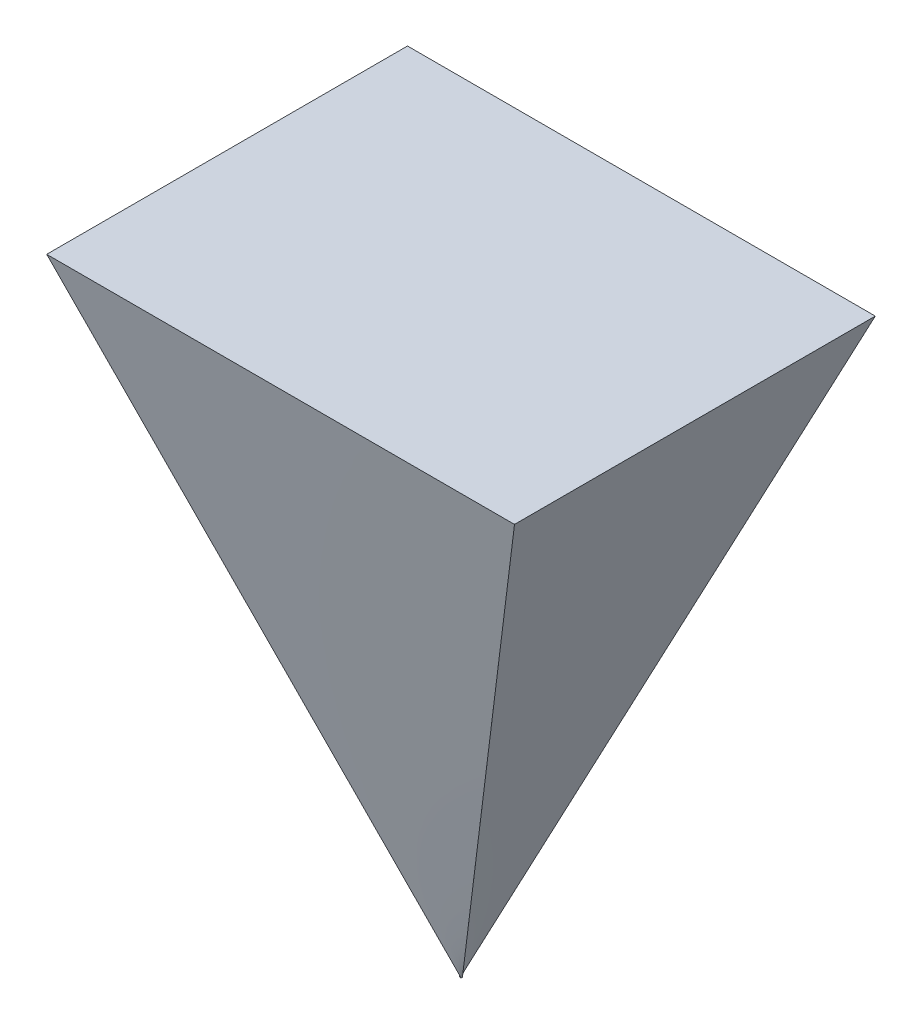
SolidWorks part; units mm, degrees
ref_plane "Front Plane" through (0, 0, 0) normal (0, 0, 1) x (1, 0, 0)
ref_plane "Top Plane" through (0, 0, 0) normal (0, 1, 0) x (1, 0, 0)
ref_plane "Right Plane" through (0, 0, 0) normal (1, 0, 0) x (0, 0, -1)
ref_plane "Plane1" through (0, 2489.2, 0) normal (0, 1, 0) x (-1, 0, 0)
ref_plane "Plane2" through (0, 4978.4, 0) normal (0, 1, 0) x (-1, 0, 0)
sketch "Sketch1" plane through (0, 0, 0) normal (0, 1, 0) x (1, 0, 0)
  line L1 (-6.477, 5.3086) -> (6.477, 5.3086)
  line L2 (-6.477, 5.3086) -> (-6.477, -5.334)
  line L3 (-6.477, -5.334) -> (6.477, -5.334)
  line L4 (6.477, 5.3086) -> (6.477, -5.334)
  dimension "D1" = 10.6426
  dimension "D2" = 12.954
  dimension "D3" = 5.334
  dimension "D4" = 6.477
sketch "Sketch2" plane through (0, 2489.2, 0) normal (0, 1, 0) x (-1, 0, 0)
  line L1 (-1468.12, 1181.1) -> (1452.88, 1181.1)
  line L2 (-1468.12, 1181.1) -> (-1468.12, -1168.4)
  line L3 (-1468.12, -1168.4) -> (1452.88, -1168.4)
  line L4 (1452.88, 1181.1) -> (1452.88, -1168.4)
  dimension "D1" = 2349.5
  dimension "D2" = 2921
  dimension "D3" = 1468.12
  dimension "D4" = 1168.4
sketch "Sketch5" plane through (0, 4978.4, 0) normal (0, 1, 0) x (-1, 0, 0)
  line L1 (-1943.1, 1498.6) -> (1943.1, 1498.6)
  line L2 (-1943.1, 1498.6) -> (-1943.1, -1498.6)
  line L3 (-1943.1, -1498.6) -> (1943.1, -1498.6)
  line L4 (1943.1, 1498.6) -> (1943.1, -1498.6)
  dimension "D1" = 3886.2
  dimension "D2" = 2997.2
  dimension "D3" = 1498.6
  dimension "D4" = 1943.1
loft "Loft7" add profiles "Sketch1", "Sketch5"
